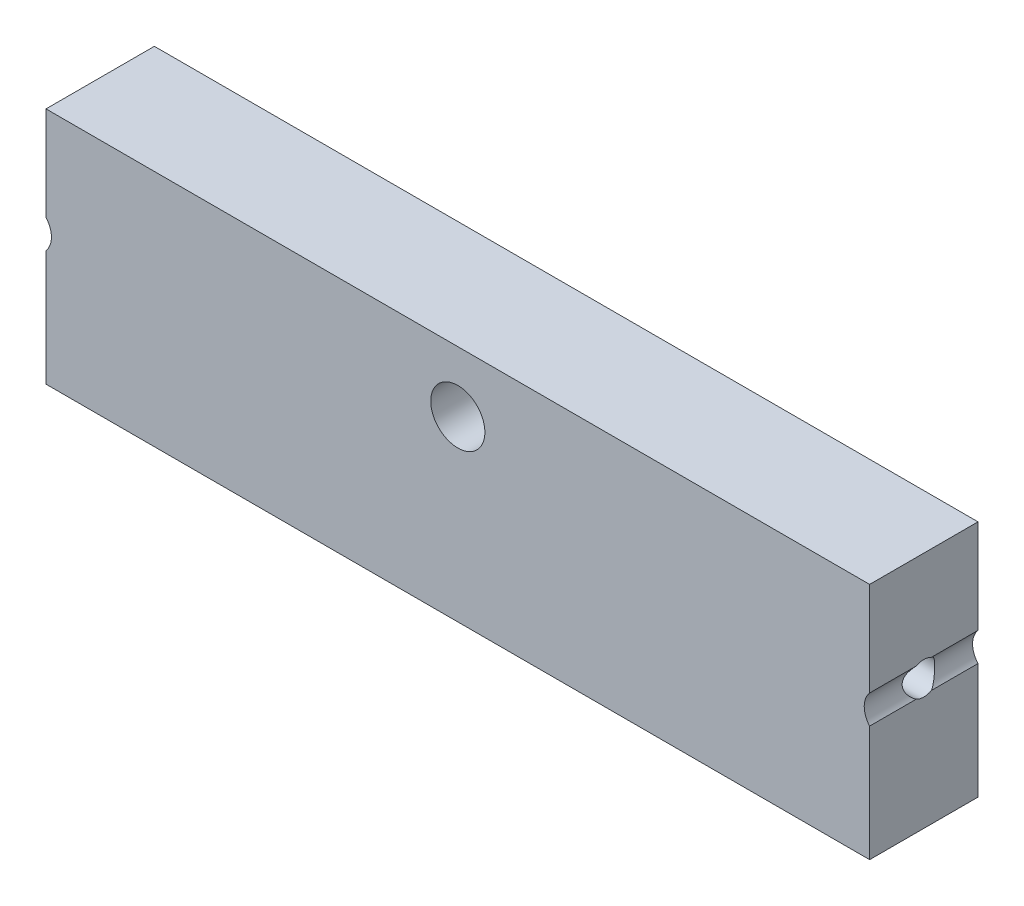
SolidWorks part; units mm, degrees
ref_plane "Face" through (0, 0, 0) normal (0, 0, 1) x (1, 0, 0)
ref_plane "Dessus" through (0, 0, 0) normal (0, 1, 0) x (1, 0, 0)
ref_plane "Droite" through (0, 0, 0) normal (1, 0, 0) x (0, 0, -1)
sketch "Esquisse1" plane through (0, 0, 0) normal (0, 0, 1) x (1, 0, 0)
  line L1 (-92.3699, 5.1766) -> (-16.3699, 5.1766)
  line L2 (-92.3699, 5.1766) -> (-92.3699, 27.1766)
  line L3 (-92.3699, 27.1766) -> (-16.3699, 27.1766)
  line L4 (-16.3699, 5.1766) -> (-16.3699, 27.1766)
  dimension "D1" = 76
  dimension "D2" = 22
extrude "Base-Extrusion" add sketch "Esquisse1" along normal blind 10
sketch "Esquisse2" plane through (0, 0, 10) normal (0, 0, 1) x (1, 0, 0)
  line L0 (-92.3699, 27.1766) -> (-92.3699, 5.1766) construction
  line L1 (-92.3699, 5.1766) -> (-16.3699, 5.1766) construction
  circle A0 centre (-54.3699, 21.5766) radius 2.5
  dimension "D1" = 5
  dimension "D2" = 38
  dimension "D3" = 16.4
extrude "Enlèv. mat.-Extru.1" cut sketch "Esquisse2" against normal up to vertex (10 mm away)
sketch "Esquisse3" plane through (-92.3699, 0, 0) normal (-1, 0, 0) x (0, 0, 1)
  line L0 (10, 27.1766) -> (0, 27.1766) construction
  line L1 (0, 27.1766) -> (0, 5.1766) construction
  circle A0 centre (5, 17.1766) radius 1.5
  dimension "D1" = 3
  dimension "D2" = 10
  dimension "D3" = 5
extrude "Enlèv. mat.-Extru.2" cut sketch "Esquisse3" against normal blind 10
sketch "Esquisse4" plane through (-16.3699, 0, 0) normal (1, 0, 0) x (0, 0, -1)
  line L0 (-10, 27.1766) -> (0, 27.1766) construction
  line L2 (0, 5.1766) -> (0, 27.1766) construction
  circle A0 centre (-5, 17.1766) radius 1.5
  dimension "D1" = 10
  dimension "D2" = 5
extrude "Enlèv. mat.-Extru.3" cut sketch "Esquisse4" against normal blind 10
sketch "Esquisse5" plane through (0, 0, 0) normal (0, 0, -1) x (-1, 0, 0)
  line L0 (92.3699, 27.1766) -> (92.3699, 5.1766) construction
  line L1 (16.3699, 27.1766) -> (92.3699, 27.1766) construction
  line L2 (16.3699, 5.1766) -> (16.3699, 27.1766) construction
  circle A0 centre (93.8699, 17.1766) radius 2
  circle A1 centre (14.8699, 17.1766) radius 2
  dimension "D1" = 1.5
  dimension "D3" = 1.5
  dimension "D2" = 10
  dimension "D4" = 10
extrude "Enlèv. mat.-Extru.4" cut sketch "Esquisse5" against normal up to vertex (10 mm away)
